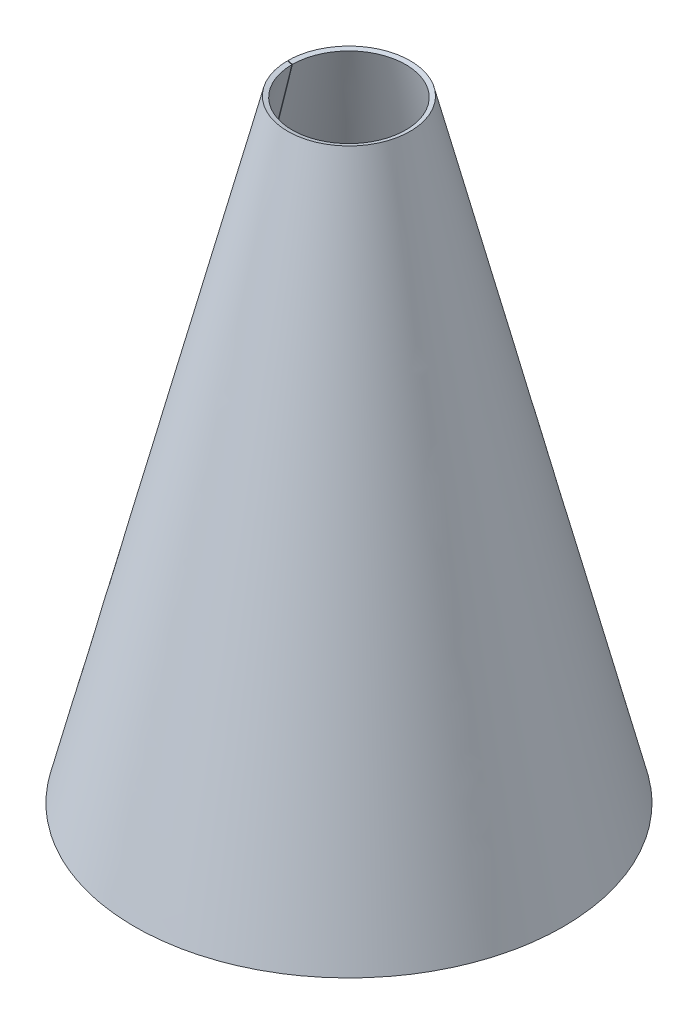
SolidWorks part; units mm, degrees
ref_plane "Plan de face" through (0, 0, 0) normal (0, 0, 1) x (1, 0, 0)
ref_plane "Plan de dessus" through (0, 0, 0) normal (0, 1, 0) x (1, 0, 0)
ref_plane "Plan de droite" through (0, 0, 0) normal (1, 0, 0) x (0, 0, -1)
sketch "Esquisse2" plane through (0, 0, 0) normal (0, 1, 0) x (1, 0, 0)
  line L0 (0, 0) -> (-175, 0) construction
  line L1 (0, 0.1) -> (-175, 0.1) construction
  line L2 (0, -0.1) -> (-175, -0.1) construction
  arc A0 (-69.9999, -0.1) -> (-69.9999, 0.1) centre (0, 0) ccw
  dimension "D1" = 140
  dimension "D2" = 0.1
  dimension "D3" = 0.1
ref_plane "Plan1" through (0, 200, 0) normal (0, 1, 0) x (1, 0, 0)
sketch "Esquisse3" plane through (0, 200, 0) normal (0, 1, 0) x (1, 0, 0)
  line L0 (0, 0) -> (-25, 0) construction
  line L1 (0, 0.1) -> (-25, 0.1) construction
  line L2 (0, -0.1) -> (-25, -0.1) construction
  arc A0 (-19.9997, -0.1) -> (-19.9997, 0.1) centre (0, 0) ccw
  dimension "D1" = 40
  dimension "D2" = 0.1
  dimension "D3" = 0.1
lofted bend "Plis de transition1" thickness 1.5 parameters "D1"=0
other "Pli libre1" parameters "D1"=1000, "D4"=57.296, "D5"=1
sketch "Esquisse4" plane through (0, 200, 0) normal (0, 1, 0) x (1, 0, 0)
  circle A0 centre (0, 0) radius 75
  dimension "D1" = 150
unfold "Déplier1"
sketch "Lignes de pliage1" [suppressed] plane through (0, 0, 0) normal (0, 1, 0) x (1, 0, 0)
sketch "Cube de visualisation1" [suppressed] plane through (0, 0, 0) normal (0, 1, 0) x (1, 0, 0)
sheet metal parameters "Tôlerie2" thickness 1.5 parameters "D1"=0.7366
flat pattern "Etat déplié2"
sketch "Lignes de pliage2" plane through (-65.8822, 16.4706, 0.1464) normal (-0.9701, 0.2425, 0.0022) x (0.0021, -0.0005, 1)
  line L0 (-0.0455, -16.9775) -> (-0.0473, 189.1778) construction
  line L1 (285.1547, 255.1372) -> (79.2266, 264.8144) construction
sketch3d "Cube de visualisation2" [suppressed]
  line L0 (0.0009, -103.0777, 0) -> (285.2034, -103.0752, 0) construction
  line L1 (-0.0016, 178.7136, 0) -> (285.2009, 178.7161, 0) construction
  line L2 (0.0009, -103.0777, 0) -> (-0.0016, 178.7136, 0) construction
  line L3 (285.2034, -103.0752, 0) -> (285.2009, 178.7161, 0) construction
other "Dépliage-<Pli libre1>1"
